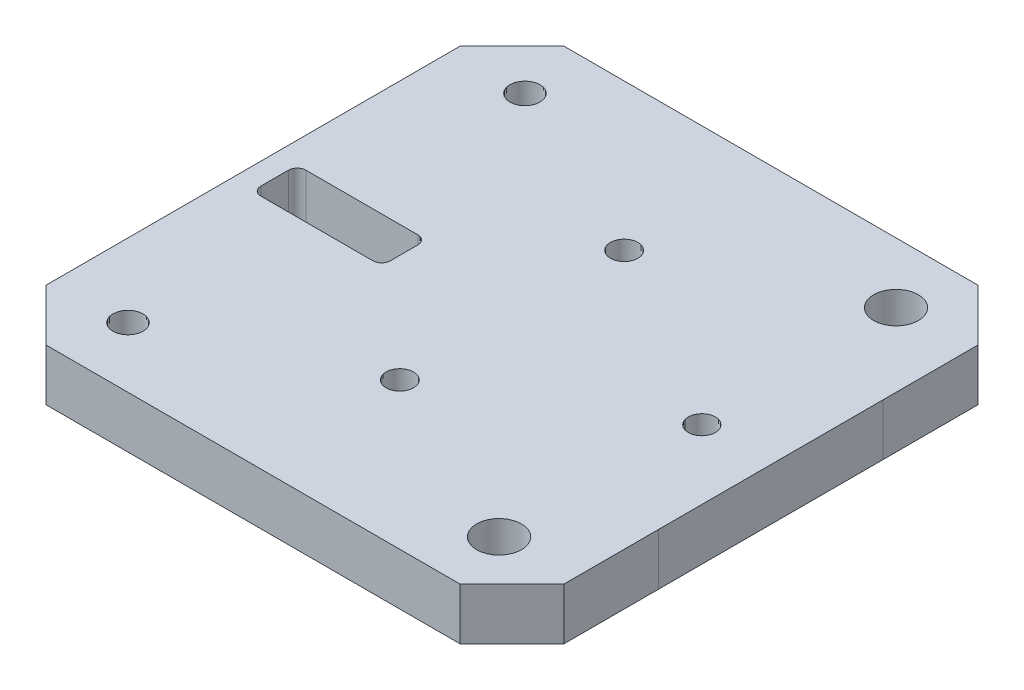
SolidWorks part; units mm, degrees
ref_plane "Alzado" through (0, 0, 0) normal (0, 0, 1) x (1, 0, 0)
ref_plane "Planta" through (0, 0, 0) normal (0, 1, 0) x (1, 0, 0)
ref_plane "Vista lateral" through (0, 0, 0) normal (1, 0, 0) x (0, 0, -1)
other "Graphic1"
other "Graphic (Closed) -1"
imported_body "Imported1"
other "Convert Mesh to Standard1"
sketch "Sketch2" plane through (0, 6, 0) normal (0, 1, 0) x (1, 0, 0)
  line L0 (-41.5, 18) -> (-41.5, -29.2171) construction
  line L5 (-20, -5) -> (-56.3474, -5) construction
  line L7 (-47.5, -2.3965) -> (-32.5, -2.3965)
  line L8 (-47.5, -2.3965) -> (-47.5, -7.6104)
  line L9 (-47.5, -7.6104) -> (-32.5, -7.6104)
  line L10 (-32.5, -2.3965) -> (-32.5, -7.6104)
  line L12 (-50, -29) -> (-50, 19) construction
  spline S0 degree 3 number of poles 76 (-38.9081, -3.4801) -> (-38.9081, -3.4801) construction
  point P2 (-41.5, -5)
  dimension "D1" = 15
  dimension "D2" = 2.5
extrude "Cut-Extrude1" cut sketch "Sketch2" against normal blind 10
sketch "Sketch3" plane through (0, 6, 0) normal (0, 1, 0) x (1, 0, 0)
  line L0 (10, 19) -> (10, -22.9528)
  line L1 (10, -22.9528) -> (36.8077, -22.9528)
  line L2 (36.8077, -22.9528) -> (36.8077, 19)
  line L3 (36.8077, 19) -> (10, 19)
extrude "Cut-Extrude2" cut sketch "Sketch3" against normal blind 10
sketch "Sketch5" plane through (0, 6, 0) normal (0, 1, 0) x (1, 0, 0)
  line L1 (-45.2909, -23.8529) -> (-37.7091, -23.8529)
  line L2 (-45.2909, -23.8529) -> (-45.2909, -32.1471)
  line L3 (-45.2909, -32.1471) -> (-37.7091, -32.1471)
  line L4 (-37.7091, -23.8529) -> (-37.7091, -32.1471)
  line L5 (-45.2909, -23.8529) -> (-37.7091, -32.1471) construction
  line L6 (-45.2909, -32.1471) -> (-37.7091, -23.8529) construction
  line L7 (-45.2909, 22.0648) -> (-37.7091, 22.0648)
  line L8 (-45.2909, 22.0648) -> (-45.2909, 13.9352)
  line L9 (-45.2909, 13.9352) -> (-37.7091, 13.9352)
  line L10 (-37.7091, 22.0648) -> (-37.7091, 13.9352)
  line L11 (-45.2909, 22.0648) -> (-37.7091, 13.9352) construction
  line L12 (-45.2909, 13.9352) -> (-37.7091, 22.0648) construction
  line L13 (-1.8471, -0.8312) -> (4.8471, -0.8312)
  line L14 (-1.8471, -0.8312) -> (-1.8471, -9.1688)
  line L15 (-1.8471, -9.1688) -> (4.8471, -9.1688)
  line L16 (4.8471, -0.8312) -> (4.8471, -9.1688)
  line L17 (-1.8471, -0.8312) -> (4.8471, -9.1688) construction
  line L18 (-1.8471, -9.1688) -> (4.8471, -0.8312) construction
  circle A0 centre (1.5, -5) radius 1.75
  circle A1 centre (-41.5, 18) radius 1.75
  circle A2 centre (-41.5, -28) radius 1.75
  dimension "D1" = 3.5
  dimension "D2" = 3.5
  dimension "D3" = 3.5
extrude "Boss-Extrude2" add sketch "Sketch5" against normal up to surface (6 mm away)
sketch "Sketch6" plane through (0, 6, 0) normal (0, 1, 0) x (1, 0, 0)
  line L1 (-28.8731, 10.1036) -> (-11.436, 10.1036)
  line L2 (-28.8731, 10.1036) -> (-28.8731, -20.0523)
  line L7 (-28.8731, -20.0523) -> (-11.436, -20.0523)
  line L8 (-11.436, 10.1036) -> (-11.436, -20.0523)
  line L9 (-28.8731, 10.1036) -> (-11.436, -20.0523) construction
  line L10 (-28.8731, -20.0523) -> (-11.436, 10.1036) construction
  point P0 (-20.1546, -4.9744)
extrude "Boss-Extrude4" add sketch "Sketch6" against normal up to surface (6 mm away)
sketch "Sketch7" plane through (0, 6, 0) normal (0, 1, 0) x (1, 0, 0)
  line L0 (-41.5, -5) -> (8.5438, -5) construction
  line L1 (-20, -28) -> (-20, 10.3391) construction
  circle A0 centre (-20, 8) radius 1.6
  circle A1 centre (-20, -18) radius 1.6
  dimension "D1" = 3.2
  dimension "D2" = 3.2
  dimension "D3" = 13
  dimension "D4" = 13
extrude "Cut-Extrude3" cut sketch "Sketch7" against normal blind 10
sketch "Sketch8" plane through (0, 6, 0) normal (0, 1, 0) x (1, 0, 0)
  line L1 (-45.1307, 8.6164) -> (-38.1558, 8.6164)
  line L2 (-45.1307, 8.6164) -> (-45.1307, 2.5646)
  line L3 (-45.1307, 2.5646) -> (-38.1558, 2.5646)
  line L4 (-38.1558, 8.6164) -> (-38.1558, 2.5646)
  line L5 (-45.1307, 8.6164) -> (-38.1558, 2.5646) construction
  line L6 (-45.1307, 2.5646) -> (-38.1558, 8.6164) construction
  line L7 (-45.0794, -11.5902) -> (-37.4891, -11.5902)
  line L8 (-45.0794, -11.5902) -> (-45.0794, -20.9242)
  line L9 (-45.0794, -20.9242) -> (-37.4891, -20.9242)
  line L10 (-37.4891, -11.5902) -> (-37.4891, -20.9242)
  line L11 (-45.0794, -11.5902) -> (-37.4891, -20.9242) construction
  line L12 (-45.0794, -20.9242) -> (-37.4891, -11.5902) construction
  line L13 (-24.6164, -23.8988) -> (-14.4619, -23.8988)
  line L14 (-24.6164, -23.8988) -> (-24.6164, -32.6173)
  line L15 (-24.6164, -32.6173) -> (-14.4619, -32.6173)
  line L16 (-14.4619, -23.8988) -> (-14.4619, -32.6173)
  line L17 (-4.9227, -12.5646) -> (4.6164, -12.5646)
  line L18 (-4.9227, -12.5646) -> (-4.9227, -19.7959)
  line L19 (-4.9227, -19.7959) -> (4.6164, -19.7959)
  line L20 (4.6164, -12.5646) -> (4.6164, -19.7959)
  line L21 (-2.7174, 9.1292) -> (4.6164, 9.1292)
  line L22 (-2.7174, 9.1292) -> (-2.7174, 2.5646)
  line L23 (-2.7174, 2.5646) -> (4.6164, 2.5646)
  line L24 (4.6164, 9.1292) -> (4.6164, 2.5646)
  line L25 (-23.8984, 21.3352) -> (-15.3337, 21.3352)
  line L26 (-23.8984, 21.3352) -> (-23.8984, 13.9501)
  line L27 (-23.8984, 13.9501) -> (-15.3337, 13.9501)
  line L28 (-15.3337, 21.3352) -> (-15.3337, 13.9501)
  point P0 (-41.6433, 5.5905)
  point P5 (-41.2843, -16.2572)
extrude "Boss-Extrude5" add sketch "Sketch8" against normal up to surface (6 mm away)
sketch "Sketch9" plane through (0, 6, 0) normal (0, 1, 0) x (1, 0, 0)
  line L1 (-2.471, 0.3989) -> (5.6873, 0.3989)
  line L2 (-2.471, 0.3989) -> (-2.471, -11.8639)
  line L3 (-2.471, -11.8639) -> (5.6873, -11.8639)
  line L4 (5.6873, 0.3989) -> (5.6873, -11.8639)
extrude "Boss-Extrude6" add sketch "Sketch9" against normal up to surface (6 mm away)
sketch "Sketch10" plane through (0, 6, 0) normal (0, 1, 0) x (1, 0, 0)
  line L0 (-41.5, -5) -> (12.1351, -5) construction
  line L1 (10, 8) -> (10, -18) construction
  circle A0 centre (2, -5) radius 1.575
  dimension "D1" = 3.15
  dimension "D2" = 8
extrude "Cut-Extrude4" cut sketch "Sketch10" against normal blind 10
fillet "Fillet1" radius 1
